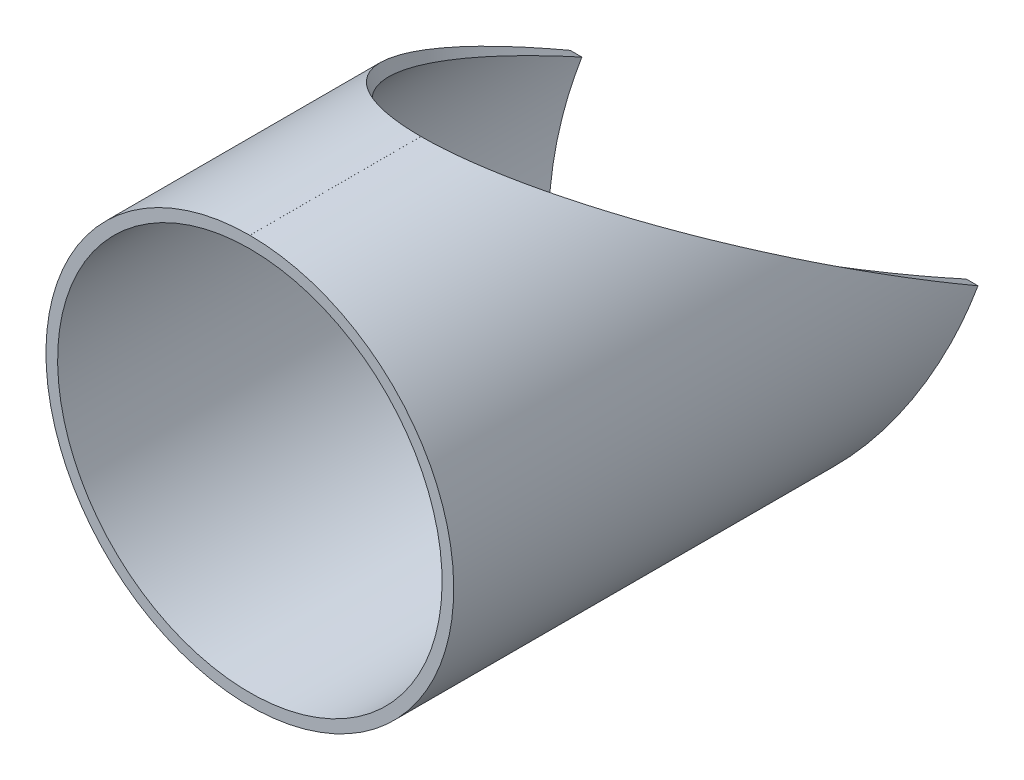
SolidWorks part; units mm, degrees
ref_plane "Ebene vorne" through (0, 0, 0) normal (0, 0, 1) x (1, 0, 0)
ref_plane "Ebene oben" through (0, 0, 0) normal (0, 1, 0) x (1, 0, 0)
ref_plane "Ebene rechts" through (0, 0, 0) normal (1, 0, 0) x (0, 0, -1)
imported_body "Importiert1"
sketch "Skizze1" plane through (0, 0, 481.5826) normal (0, 0, 1) x (1, 0, 0)
  line L0 (0, 525) -> (0, 558) construction
  line L1 (-0.005, 560) -> (0.005, 560)
  line L2 (-0.005, 560) -> (-0.005, 558)
  line L3 (-0.005, 558) -> (0.005, 558)
  line L4 (0.005, 560) -> (0.005, 558)
  circle A0 centre (0, 525) radius 33 construction
  circle A1 centre (0, 525) radius 35 construction
  point P7 (5.9367, 557.4616)
  dimension "D1" = 0.01
extrude "Schnitt-Linear austragen1" cut sketch "Skizze1" against normal through all
flatten bends "Abwickeln1" thickness 2 parameters "D1"=0
sketch "Skizze-Winkel1" plane through (-0.005, 560, 466.8935) normal (-0.0001, 1, 0) x (1, 0.0001, 0)
  line L0 (-106.8093, -14.6891) -> (-106.8093, 14.6891) construction
bend "Biegung-Rundung1" bend radius 33 bend angle 359.984 parameters "D5"=1
process bends "Abbiegen1" thickness 2 parameters "D1"=0
sketch "Abwicklung-Skizze1" plane through (-0.005, 560, 466.8935) normal (-0.0001, 1, 0) x (1, 0.0001, 0)
sketch "Biegung-Linien1" [suppressed] plane through (0, 0, 0) normal (0, 1, 0) x (1, 0, 0)
sketch "Rahmen1" [suppressed] plane through (0, 0, 0) normal (0, 1, 0) x (1, 0, 0)
sheet metal parameters "Blech3" thickness 2 parameters "D1"=1
flat pattern "Abwicklung3"
sketch "Biegung-Linien2" plane through (-0.08, 560, 0) normal (-0.0001, 1, 0) x (1, 0.0001, 0)
  line L0 (-106.7343, -481.5826) -> (-106.7343, -411.7899) construction
  line L1 (-106.7343, -481.5826) -> (-106.7343, -411.7899) construction
sketch3d "Rahmen2" [suppressed]
  line L0 (-106.8093, 75.3109, 0) -> (106.8093, 75.3109, 0) construction
  line L1 (-106.8093, -14.6891, 0) -> (106.8093, -14.6891, 0) construction
  line L2 (-106.8093, 75.3109, 0) -> (-106.8093, -14.6891, 0) construction
  line L3 (106.8093, 75.3109, 0) -> (106.8093, -14.6891, 0) construction
bend of the flat pattern "Abwickeln-<Biegung-Rundung1>1"
